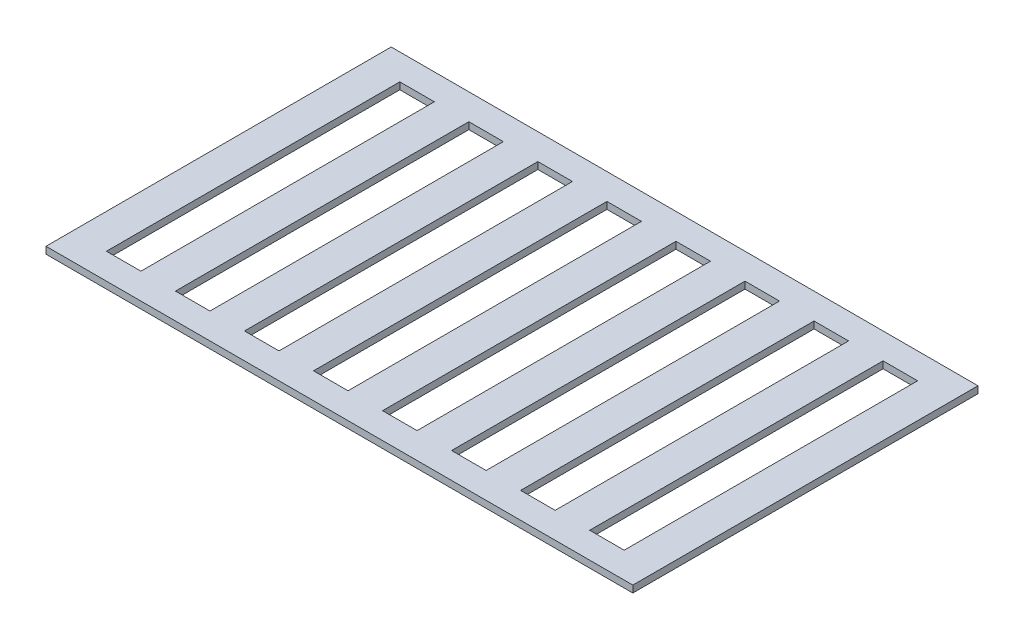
SolidWorks part; units mm, degrees
ref_plane "Front Plane" through (0, 0, 0) normal (0, 0, 1) x (1, 0, 0)
ref_plane "Top Plane" through (0, 0, 0) normal (0, 1, 0) x (1, 0, 0)
ref_plane "Right Plane" through (0, 0, 0) normal (1, 0, 0) x (0, 0, -1)
sketch "Sketch1" plane through (0, 0, 0) normal (0, 1, 0) x (1, 0, 0)
  line L0 (76.2, -19.05) -> (76.2, -234.95)
  line L1 (0, 0) -> (431.8, 0)
  line L2 (0, 0) -> (0, -254)
  line L3 (0, -254) -> (431.8, -254)
  line L4 (431.8, 0) -> (431.8, -254)
  line L5 (25.4, -19.05) -> (50.8, -19.05)
  line L6 (25.4, -19.05) -> (25.4, -234.95)
  line L7 (25.4, -234.95) -> (50.8, -234.95)
  line L8 (406.4, -19.05) -> (406.4, -234.95)
  line L9 (50.8, -19.05) -> (50.8, -234.95)
  line L10 (101.6, -19.05) -> (101.6, -234.95)
  line L11 (127, -19.05) -> (127, -234.95)
  line L12 (203.2, -19.05) -> (203.2, -234.95)
  line L13 (177.8, -19.05) -> (177.8, -234.95)
  line L14 (152.4, -19.05) -> (152.4, -234.95)
  line L15 (228.6, -19.05) -> (228.6, -234.95)
  line L16 (279.4, -19.05) -> (279.4, -234.95)
  line L17 (330.2, -19.05) -> (330.2, -234.95)
  line L18 (254, -19.05) -> (254, -234.95)
  line L19 (304.8, -19.05) -> (304.8, -234.95)
  line L20 (355.6, -19.05) -> (355.6, -234.95)
  line L21 (381, -19.05) -> (381, -234.95)
  line L22 (76.2, -19.05) -> (101.6, -19.05)
  line L23 (76.2, -234.95) -> (101.6, -234.95)
  line L24 (127, -19.05) -> (152.4, -19.05)
  line L25 (127, -234.95) -> (152.4, -234.95)
  line L26 (177.8, -234.95) -> (203.2, -234.95)
  line L27 (177.8, -19.05) -> (203.2, -19.05)
  line L28 (228.6, -19.05) -> (254, -19.05)
  line L29 (228.6, -234.95) -> (254, -234.95)
  line L30 (279.4, -234.95) -> (304.8, -234.95)
  line L31 (279.4, -19.05) -> (304.8, -19.05)
  line L32 (330.2, -19.05) -> (355.6, -19.05)
  line L33 (330.2, -234.95) -> (355.6, -234.95)
  line L34 (381, -234.95) -> (406.4, -234.95)
  line L35 (381, -19.05) -> (406.4, -19.05)
  dimension "D1" = 431.8
  dimension "D2" = 254
  dimension "D3" = 25.4
  dimension "D4" = 25.4
  dimension "D5" = 19.05
  dimension "D6" = 19.05
  dimension "D7" = 25.4
  dimension "D8" = 25.4
  dimension "D9" = 25.4
  dimension "D10" = 25.4
  dimension "D11" = 25.4
  dimension "D12" = 25.4
  dimension "D13" = 25.4
  dimension "D14" = 25.4
  dimension "D15" = 25.4
  dimension "D16" = 25.4
  dimension "D17" = 25.4
  dimension "D18" = 25.4
  dimension "D19" = 25.4
  dimension "D20" = 25.4
extrude "Boss-Extrude1" add sketch "Sketch1" along normal blind 5.08
